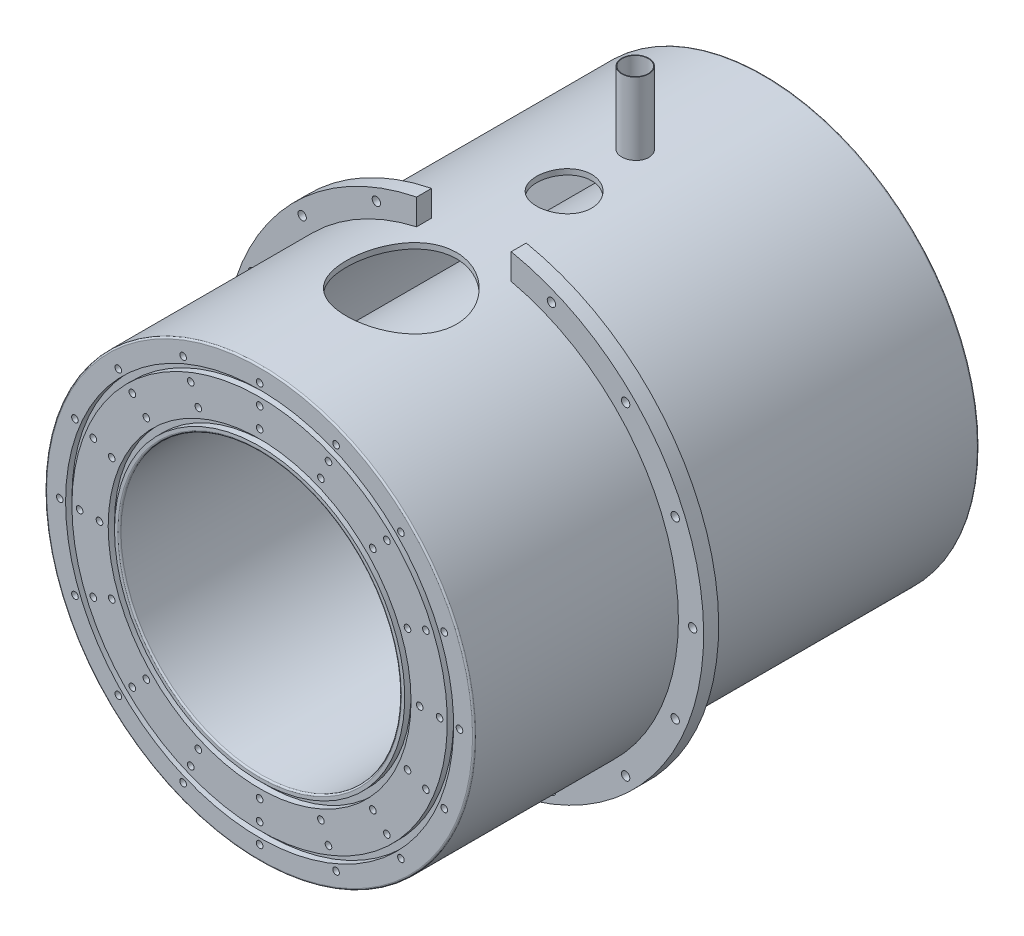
SolidWorks part; units mm, degrees
ref_plane "Front Plane" through (0, 0, 0) normal (0, 0, 1) x (1, 0, 0)
ref_plane "Top Plane" through (0, 0, 0) normal (0, 1, 0) x (1, 0, 0)
ref_plane "Right Plane" through (0, 0, 0) normal (1, 0, 0) x (0, 0, -1)
sketch "Sketch1" plane through (0, 0, 0) normal (0, 0, 1) x (1, 0, 0)
  line L0 (0, 83.7519) -> (0, -89.1992) construction
  circle A0 centre (0, 0) radius 92
  circle A1 centre (0, 0) radius 88.9
  dimension "D1" = 184
  dimension "D2" = 177.8
extrude "Boss-Extrude1" add sketch "Sketch1" along normal mid plane 280
sketch "Sketch2" plane through (0, 0, 0) normal (0, 0, 1) x (1, 0, 0)
  circle A0 centre (0, 0) radius 132.5
  circle A1 centre (0, 0) radius 136
  dimension "D1" = 265
  dimension "D2" = 272
extrude "Boss-Extrude2" add sketch "Sketch2" along normal mid plane 280 separate body
sketch "Sketch3" plane through (0, 0, -140) normal (0, 0, -1) x (-1, 0, 0)
  circle A0 centre (0, 0) radius 136
  circle A1 centre (0, 0) radius 136 construction
  circle A2 centre (0, 0) radius 88.9
  dimension "D1" = 272
  dimension "D2" = 177.8
extrude "Boss-Extrude3" add sketch "Sketch3" along normal blind 20
mirror "Mirror1" about plane through (0, 0, 0) normal (0, 0, 1) of "Boss-Extrude3"
sketch "Sketch4" plane through (0, 0, -160) normal (0, 0, -1) x (-1, 0, 0)
  line L0 (0, 143.175) -> (0, -142.8576) construction
  line L1 (-147.4832, 0) -> (156.6447, 0) construction
  circle A0 centre (0, 0) radius 101.5 construction
  circle A1 centre (0, 0) radius 114.1 construction
  circle A2 centre (0, 0) radius 126.7 construction
  circle A3 centre (0, 0) radius 88.9 construction
  circle A4 centre (101.5, 0) radius 1.7272
  circle A5 centre (114.1, 0) radius 1.7272
  circle A6 centre (126.7, 0) radius 1.7272
  dimension "D1" = 12.6
  dimension "D2" = 12.6
  dimension "D3" = 12.6
  dimension "D4" = 3.4544
ref_plane "Plane1" through (0, 114.3, 0) normal (0, 1, 0) x (-1, 0, 0)
sketch "Sketch6" plane through (0, 114.3, 0) normal (0, 1, 0) x (-1, 0, 0)
  line L0 (0, 185.8322) -> (0, -184.7362) construction
  line L1 (136, 160) -> (-136, 160) construction
  line L2 (-136, -160) -> (136, -160) construction
  circle A0 centre (0, -33) radius 17.4625
  circle A1 centre (0, 70.1395) radius 34.925
  dimension "D1" = 34.925
  dimension "D2" = 69.85
  dimension "D3" = 89.8605
  dimension "D4" = 127
extrude "Cut-Extrude5" cut sketch "Sketch6" along normal blind 25.4
ref_plane "Plane4" through (0, 130.81, 0) normal (0, 1, 0) x (-1, 0, 0)
sketch "Sketch5" plane through (0, 130.81, 0) normal (0, 1, 0) x (-1, 0, 0)
  line L0 (0, 191.1911) -> (0, -186.018) construction
  line L1 (-167.6964, 0) -> (167.6964, 0) construction
  line L2 (136, 160) -> (-136, 160) construction
  circle A0 centre (0, -78.125) radius 8.255
  dimension "D1" = 16.51
  dimension "D3" = 238.125
extrude "Extrude-Thin1" add sketch "Sketch5" along normal blind 50.8 separate body thin
ref_plane "Plane5" through (0, 0, 25.4) normal (0, 0, 1) x (1, 0, 0)
sketch "Sketch7" plane through (0, 0, 25.4) normal (0, 0, 1) x (1, 0, 0)
  circle A0 centre (0, 0) radius 145.525
  circle A1 centre (0, 0) radius 136 construction
  dimension "D1" = 9.525
ref_plane "Plane6" through (0, 0, 30.5) normal (0, 0, -1) x (-1, 0, 0)
sketch "Sketch8" plane through (0, 0, 30.5) normal (0, 0, -1) x (-1, 0, 0)
  circle A0 centre (0, 0) radius 145 construction
  circle A1 centre (0, 0) radius 152
  circle A2 centre (0, 0) radius 136
  circle A3 centre (0, 0) radius 136 construction
  dimension "D1" = 290
  dimension "D2" = 304
extrude "Boss-Extrude5" add sketch "Sketch8" along normal blind 9.525
sketch "Sketch9" plane through (0, 0, 20.975) normal (0, 0, -1) x (-1, 0, 0)
  line L0 (0, 178.2951) -> (0, -164.2466) construction
  line L1 (-170.1004, 0) -> (184.1454, 0) construction
  circle A0 centre (0, 145) radius 1.632
  circle A1 centre (0, 0) radius 145 construction
  dimension "D1" = 3.2639
sketch "Sketch10" plane through (0, 0, -160) normal (0, 0, -1) x (-1, 0, 0)
  circle A0 centre (0, 0) radius 123
  circle A1 centre (0, 0) radius 119
  circle A2 centre (0, 0) radius 96 construction
  circle A3 centre (0, 0) radius 92 construction
  dimension "D1" = 246
  dimension "D2" = 238
  dimension "D3" = 184
  dimension "D4" = 192
extrude "Cut-Extrude7" cut sketch "Sketch10" against normal blind 4
sketch "Sketch11" plane through (0, 0, -160) normal (0, 0, -1) x (-1, 0, 0)
  circle A0 centre (0, 0) radius 96
  circle A1 centre (0, 0) radius 92
  dimension "D1" = 192
  dimension "D2" = 184
extrude "Cut-Extrude8" cut sketch "Sketch11" against normal blind 4
mirror "Mirror3" about plane through (0, 0, 0) normal (0, 0, 1) of "Cut-Extrude8", "Cut-Extrude7"
hole_wizard "M5x0.8 Tapped Hole1" positions "3DSketch1" profile "Sketch12" tap size "M5x0.8" standard "Ansi Metric"
sketch3d "3DSketch1"
  point P0 (-101.5, 0, -160)
  point P3 (-114.1, 0, -160)
  point P6 (-126.7, 0, -160)
sketch "Sketch12" plane through (-101.5, 0, -160) normal (1, 0, 0) x (0, 1, 0)
  line L0 (0, 0) -> (0, 13.6618)
  line L1 (0, 13.6618) -> (2.1, 12.4)
  line L2 (2.1, 12.4) -> (2.1, 0)
  line L5 (2.1, 0) -> (0, 0)
  line L10 (0, 13.6618) -> (-2.1, 12.4) construction
  line L11 (0, -6.35) -> (0, 107.95) construction
  dimension "Tap Drill Dia." = 4.2
  dimension "Tap Drill Depth" = 12.4
  dimension "Drill Angle" = 118
hole_wizard "M5 Clearance Hole1" positions "3DSketch2" profile "Sketch13" hole size "M5" standard "Ansi Metric"
sketch3d "3DSketch2"
  point P0 (0, 145, 20.975)
sketch "Sketch13" plane through (0, 145, 20.975) normal (1, 0, 0) x (0, 1, 0)
  line L0 (0, 0) -> (0, 26.9923)
  line L1 (0, 26.9923) -> (2.65, 25.4)
  line L2 (2.65, 25.4) -> (2.65, 0)
  line L5 (2.65, 0) -> (0, 0)
  line L10 (0, 26.9923) -> (-2.65, 25.4) construction
  line L11 (0, -6.35) -> (0, 107.95) construction
  dimension "Hole Dia." = 5.3
  dimension "Hole Depth" = 25.4
  dimension "Drill Angle" = 118
pattern_circular "CirPattern4" count 16 over 360 about axis through (0, 0, 0) along (0, 0, 1) of "M5 Clearance Hole1"
mirror "Mirror4" about plane through (0, 0, 0) normal (0, 0, 1) of "M5x0.8 Tapped Hole1"
pattern_circular "CirPattern5" count 16 over 360 about axis through (0, 0, 0) along (0, 0, 1) of "M5x0.8 Tapped Hole1", "Mirror4"
fillet "Fillet2" radius 1 4 edges at (-136, 0, 160) (-88.9, 0, 160) (-88.9, 0, -160) (-136, 0, -160)
sketch "Sketch14" plane through (0, 0, 30.5) normal (0, 0, 1) x (1, 0, 0)
  line L0 (0, 155) -> (0, -157.7174) construction
  line L1 (-166.7771, 0) -> (183.4812, 0) construction
  line L2 (30, 132.6499) -> (30, 155)
  line L3 (30, 155) -> (-30, 155)
  line L4 (-30, 155) -> (-30, 132.6499)
  arc A0 (30, 132.6499) -> (-30, 132.6499) centre (0, 0) ccw
  dimension "D2" = 272
  dimension "D1" = 60
  dimension "D3" = 155
extrude "Cut-Extrude9" cut sketch "Sketch14" against normal blind 15 and the other way blind 10
